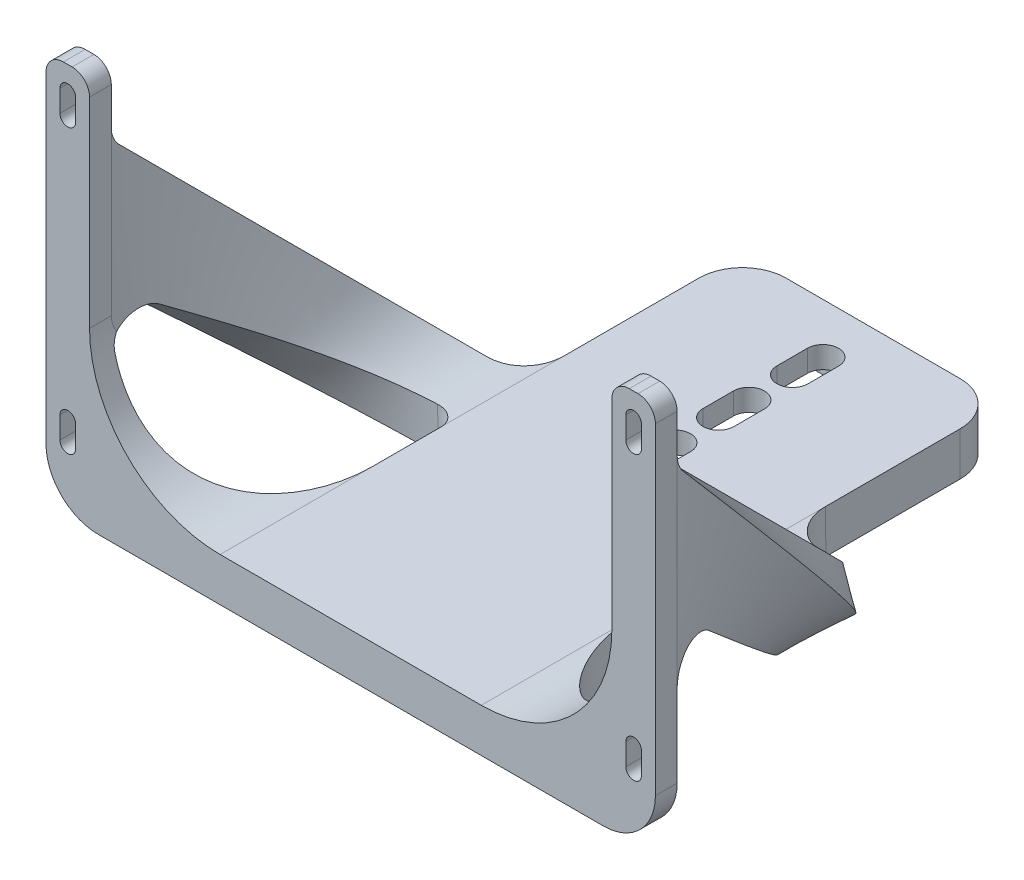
SolidWorks part; units mm, degrees
ref_plane "Ebene vorne" through (0, 0, 0) normal (0, 0, 1) x (1, 0, 0)
ref_plane "Ebene oben" through (0, 0, 0) normal (0, 1, 0) x (1, 0, 0)
ref_plane "Ebene rechts" through (0, 0, 0) normal (1, 0, 0) x (0, 0, -1)
sketch "Skizze1" plane through (0, 0, 0) normal (0, 0, 1) x (1, 0, 0)
  line L1 (-30, 2.5) -> (30, 2.5)
  line L2 (-30, 2.5) -> (-30, -2.5)
  line L3 (-30, -2.5) -> (30, -2.5)
  line L4 (30, 2.5) -> (30, -2.5)
  line L5 (-30, 2.5) -> (30, -2.5) construction
  line L6 (-30, -2.5) -> (30, 2.5) construction
  point P0 (0, 0)
  dimension "D1" = 60
  dimension "D2" = 5
extrude "Aufsatz-Linear austragen1" add sketch "Skizze1" along normal blind 120
sketch "Skizze6" plane through (0, 0, 120) normal (0, 0, -1) x (-1, 0, 0)
  line L0 (-70, 82.5) -> (-70, -2.5)
  line L1 (-70, -2.5) -> (70, -2.5)
  line L2 (70, -2.5) -> (70, 82.5)
  line L3 (70, 82.5) -> (60, 82.5)
  line L4 (60, 82.5) -> (60, 32.5)
  line L5 (30, 2.5) -> (-30, 2.5)
  line L6 (-60, 32.5) -> (-60, 82.5)
  line L7 (-60, 82.5) -> (-70, 82.5)
  line L8 (30, -2.5) -> (-30, -2.5) construction
  line L9 (-30, 2.5) -> (30, 2.5) construction
  arc A0 (60, 32.5) -> (30, 2.5) centre (30, 32.5) cw
  arc A1 (-30, 2.5) -> (-60, 32.5) centre (-30, 32.5) cw
  point P13 (0, 2.5)
  point P16 (60, 2.5)
  point P19 (-60, 2.5)
  dimension "D4" = 30
  dimension "D1" = 85
  dimension "D2" = 10
  dimension "D3" = 120
extrude "Aufsatz-Linear austragen2" add sketch "Skizze6" along normal blind 5
hole_wizard "Durchgangsloch für 1/43" positions "Skizze4" profile "Skizze5" size "1/4" standard "ANSI Inch"
sketch "Skizze4" plane through (0, 2.5, 0) normal (0, 1, 0) x (1, 0, 0)
  line L0 (0, -18.5) -> (0, -11.5) construction
  point P0 (0, -15)
  point P2 (0, -32)
  point P5 (0, -49)
  dimension "D1" = 7
  dimension "D2" = 17
  dimension "D3" = 17
  dimension "D4" = 15
sketch "Skizze5" plane through (0, 2.5, 15) normal (1, 0, 0) x (0, 0, 1)
  line L0 (0, 0) -> (0, 11.1458)
  line L1 (0, 11.1458) -> (3.5712, 9)
  line L2 (3.5712, 9) -> (3.5712, 0)
  line L5 (3.5712, 0) -> (0, 0)
  line L10 (0, 11.1458) -> (-3.5712, 9) construction
  line L11 (0, -6.35) -> (0, 107.95) construction
  dimension "Bohrerdurchmesser" = 7.1425
  dimension "Bohrungstiefe" = 9
  dimension "Spitzenwinkel" = 118
fillet "Verrundung2" radius 30 2 edges at (-30, 0, 115) (30, 0, 115)
sketch "Skizze15" plane through (0, -2.5, 0) normal (0, -1, 0) x (1, 0, 0)
  line L8 (70, 120) -> (-70, 120)
  line L9 (-70, 120) -> (-70, 115)
  line L10 (-70, 115) -> (-60, 115)
  line L11 (-30, 85) -> (-30, 0)
  line L12 (-30, 0) -> (30, 0)
  line L13 (30, 0) -> (30, 85)
  line L14 (60, 115) -> (70, 115)
  line L15 (70, 115) -> (70, 120)
  line L16 (70, 120) -> (-70, 120)
  line L17 (-70, 120) -> (-70, 115)
  line L18 (-70, 115) -> (-60, 115)
  line L19 (-30, 85) -> (-30, 0)
  line L20 (-30, 0) -> (30, 0)
  line L21 (30, 0) -> (30, 85)
  line L22 (60, 115) -> (70, 115)
  line L23 (70, 115) -> (70, 120)
  arc A2 (-30, 85) -> (-60, 115) centre (-60, 85) ccw
  arc A3 (60, 115) -> (30, 85) centre (60, 85) ccw
  arc A4 (-30, 85) -> (-60, 115) centre (-60, 85) ccw
  arc A5 (60, 115) -> (30, 85) centre (60, 85) ccw
  dimension "D1" = 0
extrude "Linear-Austragen-Dünn2" add sketch "Skizze15" along normal blind 5 thin
sketch "Skizze8" plane through (0, 0, 115) normal (0, 0, -1) x (-1, 0, 0)
  line L0 (-70, 82.5) -> (-70, -7.5) construction
  line L1 (-70, 67.5) -> (-60, 67.5)
  line L2 (-70, 67.5) -> (-70, 37.5)
  line L3 (-70, 37.5) -> (-60, 37.5)
  line L4 (-60, 67.5) -> (-60, 37.5)
  line L6 (-60, 82.5) -> (-70, 82.5) construction
  line L7 (-60, 32.5) -> (-60, 82.5) construction
  dimension "D1" = 30
  dimension "D2" = 15
sketch "Skizze9" plane through (30, 0, 0) normal (1, 0, 0) x (0, 0, -1)
  line L0 (-85, 2.5) -> (0, 2.5) construction
  line L1 (-65, 2.5) -> (-50, 2.5)
  line L2 (-65, 2.5) -> (-65, -7.5)
  line L3 (-65, -7.5) -> (-50, -7.5)
  line L4 (-50, 2.5) -> (-50, -7.5)
  line L6 (0, -7.5) -> (0, 2.5) construction
  line L7 (0, -7.5) -> (-85, -7.5) construction
  dimension "D1" = 50
  dimension "D2" = 15
loft "Ausformung1" add profiles "Skizze8", "Skizze9"
mirror "Spiegeln1" about plane through (0, 0, 0) normal (1, 0, 0) of "Ausformung1"
sketch "Skizze12" plane through (0, 0, 115) normal (0, 0, -1) x (-1, 0, 0)
  line L2 (-65, 71.87) -> (-65, 76.87) construction
  point P112 (-65, 74.37)
  point P115 (-65, 9.37)
  point P118 (65, 9.37)
  point P121 (65, 74.37)
  dimension "D1" = 5
hole_wizard "Durchgangsloch für M32" positions "Skizze12" profile "Skizze13" size "M3" standard "DIN"
sketch "Skizze13" plane through (65, 74.37, 115) normal (1, 0, 0) x (0, 1, 0)
  line L0 (0, 0) -> (0, 5)
  line L1 (0, 5) -> (1.8, 5)
  line L2 (1.8, 5) -> (1.8, 0)
  line L5 (1.8, 0) -> (0, 0)
  line L11 (0, -6.35) -> (0, 107.95) construction
  dimension "Bohrerdurchmesser" = 3.6
  dimension "Bohrungstiefe" = 5
fillet "Verrundung3" radius 4 2 edges
fillet "Verrundung4" radius 10 2 edges
fillet "Verrundung5" radius 6 15 edges at (46.7379, 7.6033, 111.9094)
fillet "Verrundung6" radius 10 2 edges at (-30, -2.5, 0) (30, -2.5, 0)
fillet "Verrundung7" radius 4 4 edges at (-70, 82.5, 117.5) (-60, 82.5, 117.5) (60, 82.5, 117.5) (70, 82.5, 117.5)
fillet "Verrundung8" radius 12 4 edges at (65, -7.5, 115) (70, -7.5, 117.5) (-70, -7.5, 117.5) (-65, -7.5, 115)
